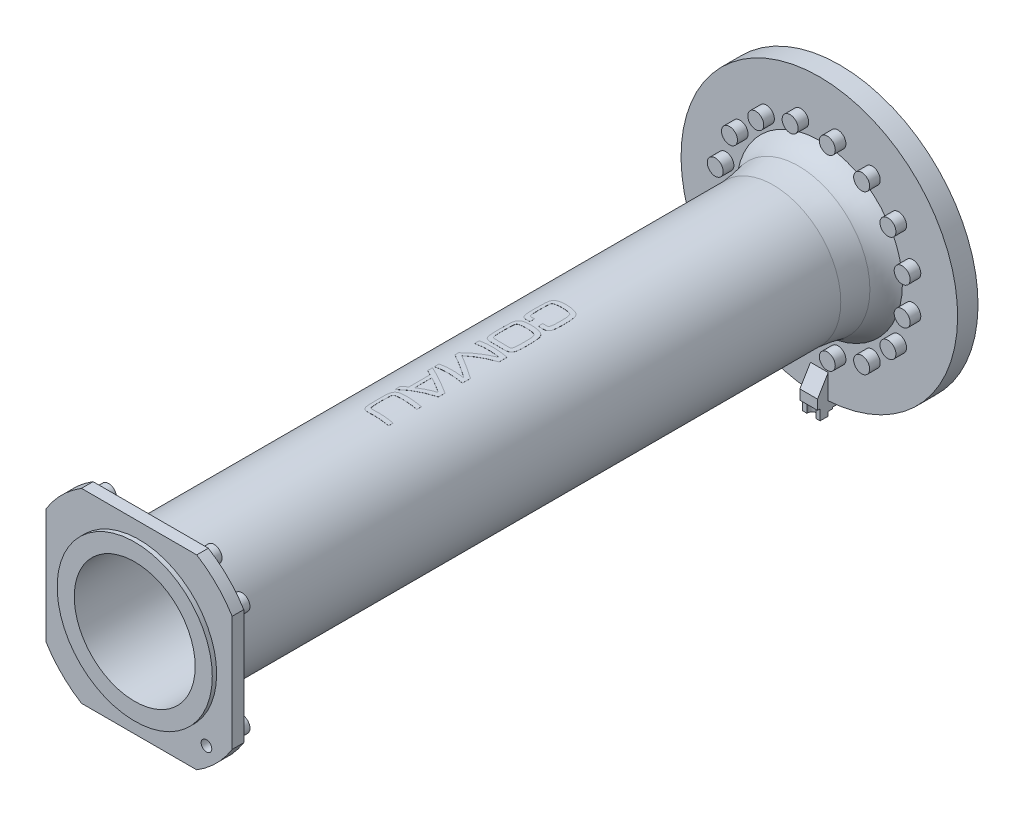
SolidWorks part; units mm, degrees
ref_plane "Piano1 (Front/Back)" through (0, 0, 0) normal (0, 0, 1) x (1, 0, 0)
ref_plane "Piano2 (Top/Bottom)" through (0, 0, 0) normal (0, 1, 0) x (1, 0, 0)
ref_plane "Piano3 (Left/Right)" through (0, 0, 0) normal (1, 0, 0) x (0, 0, -1)
imported_body "Importato1"
sketch "Schizzo1" plane through (0, 0, 0) normal (0, 1, 0) x (1, 0, 0)
  line L0 (-15, -759.25) -> (-15, -75.0079) construction
  line L1 (76.2, -759.25) -> (-76.2, -759.25) construction
  line L2 (76.2, -75.0079) -> (-76.2, -75.0079) construction
  text T0 "COMAU" font "MicrogrammaDMedExt" height 31.5
  dimension "D1" = 15
extrude "Estrusione1" add sketch "Schizzo1" against normal offset from surface (75.5969 mm away) 0.1
sketch "Schizzo2" plane through (0, 0, 0) normal (0, 1, 0) x (1, 0, 0)
  line L0 (-15, -75.0079) -> (-15, -759.25) construction
  line L1 (76.2, -75.0079) -> (-76.2, -75.0079) construction
  line L2 (76.2, -759.25) -> (-76.2, -759.25) construction
  text T0 "COMAU" font "MicrogrammaDMedExt" height 31.5
  dimension "D1" = 15
extrude "Estrusione2" add sketch "Schizzo2" along normal offset from surface (75.5969 mm away) 0.1
sketch "Schizzo3" plane through (0, 0, 795.25) normal (0, 0, 1) x (1, 0, 0)
  circle A0 centre (0, 0) radius 68.2 construction
  circle A1 centre (0, 0) radius 68.2
extrude "Taglio-Estrusione1" cut sketch "Schizzo3" against normal through all
